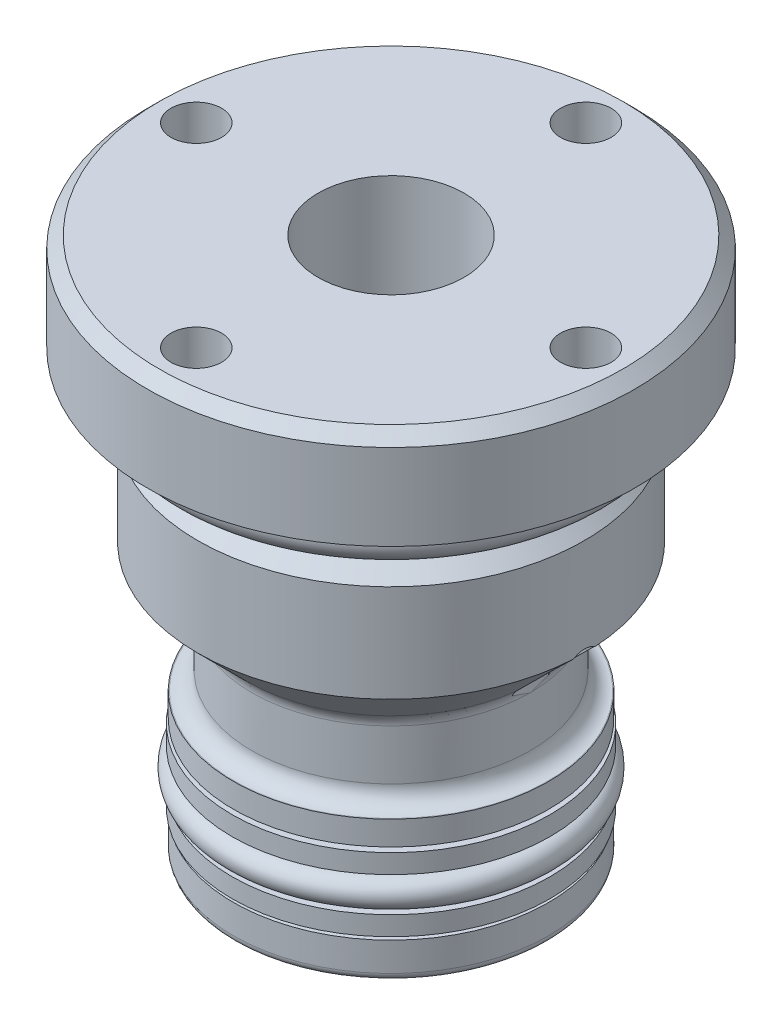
SolidWorks part; units mm, degrees
ref_plane "Front Plane" through (0, 0, 0) normal (0, 0, 1) x (1, 0, 0)
ref_plane "Top Plane" through (0, 0, 0) normal (0, 1, 0) x (1, 0, 0)
ref_plane "Right Plane" through (0, 0, 0) normal (1, 0, 0) x (0, 0, -1)
sketch "Sketch1" plane through (0, 0, 0) normal (0, 0, 1) x (1, 0, 0)
  line L0 (0, 0) -> (0, 29.1031) construction
  line L1 (-7.9375, 0) -> (-7.9375, 18.2372)
  line L2 (-7.9375, 18.2372) -> (-4.7625, 18.2372)
  line L3 (-4.7625, 18.2372) -> (-4.7625, 34.925)
  line L4 (-4.7625, 34.925) -> (-15.875, 34.925)
  line L5 (-15.875, 34.925) -> (-15.875, 28.575)
  line L6 (-15.875, 28.575) -> (-12.6111, 28.575)
  line L7 (-12.6111, 28.575) -> (-12.6111, 17.6403)
  line L8 (-12.6111, 17.6403) -> (-9.0805, 14.1097)
  line L9 (-9.0805, 14.1097) -> (-9.0805, 9.2202)
  line L10 (-9.0805, 9.2202) -> (-10.2743, 9.2202)
  line L11 (-10.2743, 9.2202) -> (-10.2743, 7.6454)
  line L12 (-10.2743, 7.6454) -> (-9.017, 7.6454)
  line L13 (-9.017, 7.6454) -> (-9.017, 2.3876)
  line L14 (-9.017, 2.3876) -> (-10.2743, 2.3876)
  line L15 (-10.2743, 2.3876) -> (-10.2743, 0)
  line L16 (-10.2743, 0) -> (-7.9375, 0)
  dimension "D1" = 18.2372
  dimension "D2" = 34.925
  dimension "D3" = 31.75
  dimension "D4" = 9.525
  dimension "D5" = 15.875
  dimension "D6" = 20.5486
  dimension "D7" = 2.3876
  dimension "D8" = 1.5748
  dimension "D9" = 18.034
  dimension "D10" = 5.2578
  dimension "D11" = 6.35
  dimension "D12" = 25.2222
  dimension "D13" = 18.161
  dimension "D14" = 10.9347
  dimension "D15" = 45
revolve "Revolve1" add sketch "Sketch1" angle 360 about L0
fillet "Fillet1" radius 1.143 2 edges at (0, 14.1097, -9.0805) (0, 9.2202, -9.0805)
fillet "Fillet2" radius 0.381 2 edges at (0, 7.6454, -9.017) (0, 2.3876, -9.017)
fillet "Fillet3" radius 0.508 1 edges at (0, 0, -10.2743)
hole_wizard "Hole1" positions "Sketch3" profile "Sketch2" legacy
sketch "Sketch3" plane through (0, 34.925, 0) normal (0, 1, 0) x (-1, 0, 0)
  circle A0 centre (0, 0) radius 12.7 construction
  point P0 (-12.7, 0)
  dimension "D1" = 25.4
sketch "Sketch2" plane through (12.7, 34.925, 0) normal (1, 0, 0) x (0, 0, 1)
  line L0 (0, 0) -> (0, 4.167)
  line L1 (0, 4.167) -> (1.651, 3.175)
  line L2 (1.651, 3.175) -> (1.651, 0)
  line L4 (1.651, 0) -> (0, 0)
  line L6 (0, 4.167) -> (-1.651, 3.175) construction
  line L7 (0, -4.2442) -> (0, 117.3081) construction
  dimension "Diameter" = 3.302
  dimension "Depth" = 3.175
  dimension "Drill Angle" = 118
pattern_circular "CirPattern1" count 4 over 360 about axis through (0, 0, 0) along (0, 1, 0) of "Hole1"
chamfer "Chamfer1" distance 0.762 angle 45 1 edges at (0, 34.925, -15.875)
sketch "Sketch4" plane through (0, 0, 0) normal (0, 0, 1) x (1, 0, 0)
  line L0 (0, 0) -> (0, 41.4124) construction
  line L1 (-12.6111, 28.575) -> (-12.6111, 23.9903)
  line L2 (-12.6111, 28.575) -> (-12.6111, 17.6403) construction
  line L3 (-12.6111, 23.9903) -> (-11.4808, 25.1206)
  line L4 (-11.4808, 25.1206) -> (-11.4808, 28.575)
  line L5 (-12.6111, 28.575) -> (12.6111, 28.575) construction
  line L6 (-11.4808, 28.575) -> (-12.6111, 28.575)
  dimension "D1" = 22.9616
  dimension "D2" = 4.5847
  dimension "D3" = 45
revolve "Cut-Revolve1" cut sketch "Sketch4" angle 360 about L0
fillet "Fillet4" radius 0.381 2 edges at (0, 25.1206, -11.4808) (0, 28.575, -11.4808)
sketch "Sketch5" plane through (0, 0, 0) normal (0, 0, 1) x (1, 0, 0)
  line L0 (-15.875, 28.575) -> (15.875, 28.575) construction
  line L1 (0, 0) -> (0, 42.572) construction
  circle A0 centre (-12.7508, 27.2288) radius 1.3081
  dimension "D2" = 2.6162
  dimension "D1" = 1.3462
  dimension "D3" = 25.5016
revolve "Revolve2" add sketch "Sketch5" angle 360 about L1
sketch "Sketch6" plane through (0, 0, 0) normal (0, 0, 1) x (1, 0, 0)
  line L0 (0, 0) -> (0, 49.5791) construction
  line L1 (-9.017, 7.2644) -> (-9.017, 2.7686) construction
  line L2 (-9.017, 6.1468) -> (-10.3632, 6.1468)
  line L3 (-9.017, 6.1468) -> (-9.017, 7.3914)
  line L4 (-9.017, 7.3914) -> (-10.3632, 7.3914)
  line L5 (-10.3632, 6.1468) -> (-10.3632, 7.3914)
  line L6 (-9.017, 5.0165) -> (-17.8863, 5.0165) construction
  line L7 (-10.3632, 3.8862) -> (-10.3632, 2.6416)
  line L8 (-9.017, 2.6416) -> (-10.3632, 2.6416)
  line L9 (-9.017, 3.8862) -> (-9.017, 2.6416)
  line L10 (-9.017, 3.8862) -> (-10.3632, 3.8862)
  line L11 (10.2743, 2.3876) -> (-10.2743, 2.3876) construction
  circle A0 centre (-9.8552, 4.9276) radius 0.889
  dimension "D4" = 1.778
  dimension "D5" = 19.7104
  dimension "D6" = 2.54
  dimension "D1" = 1.2446
  dimension "D2" = 20.7264
  dimension "D3" = 2.2606
revolve "Revolve3" add sketch "Sketch6" angle 360 about L0
sketch "Sketch7" plane through (0, 0, 0) normal (1, 0, 0) x (0, 0, -1)
  line L0 (-9.7663, 0) -> (9.7663, 0) construction
  circle A0 centre (0, 16.6878) radius 1.1811
  dimension "D1" = 2.3622
  dimension "D2" = 16.6878
extrude "Cut-Extrude1" cut sketch "Sketch7" against normal through all and the other way through all
sketch "Sketch8" plane through (0, 0, 0) normal (1, 0, 0) x (0, 0, -1)
  line L0 (-1.1811, 16.6878) -> (-1.1811, 11.9253)
  line L1 (0, 16.6878) -> (0, 11.9253) construction
  line L2 (1.1811, 16.6878) -> (1.1811, 11.9253)
  arc A0 (1.1811, 16.6878) -> (-1.1811, 16.6878) centre (0, 16.6878) ccw
  arc A1 (-1.1811, 11.9253) -> (1.1811, 11.9253) centre (0, 11.9253) ccw
  arc A2 (-0.6984, 17.6403) -> (0.6984, 17.6403) centre (0, 16.6878) ccw construction
  dimension "D1" = 4.7625
extrude "Cut-Extrude3" cut sketch "Sketch8" along normal blind 25.4 from offset 9.0805
mirror "Mirror1" about plane through (0, 0, 0) normal (1, 0, 0) of "Cut-Extrude3"
